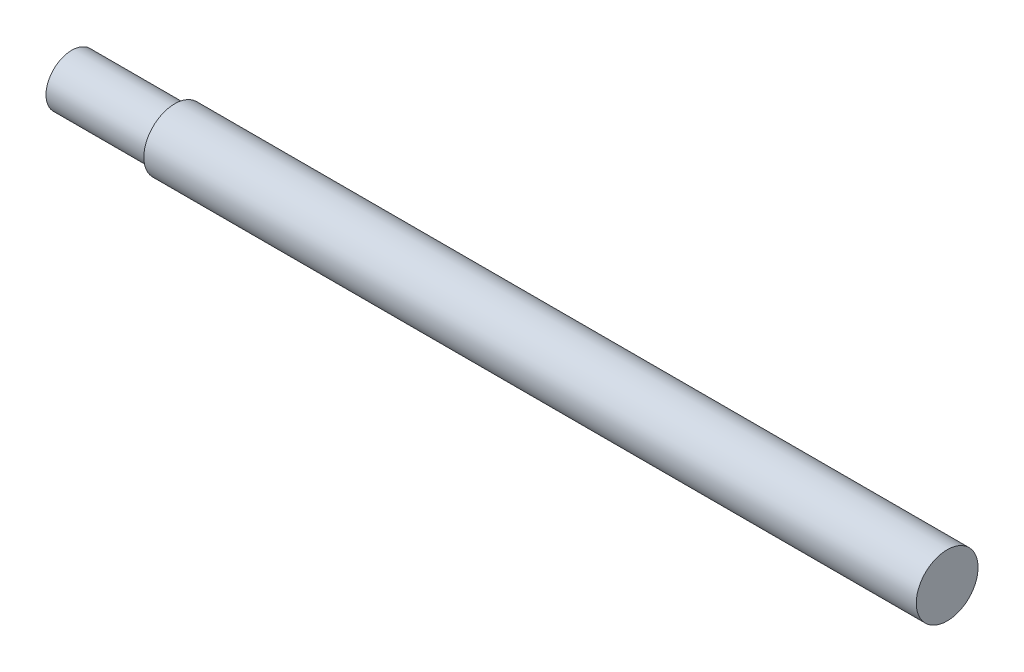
SolidWorks part; units mm, degrees
ref_plane "Face" through (0, 0, 0) normal (0, 0, 1) x (1, 0, 0)
ref_plane "Dessus" through (0, 0, 0) normal (0, 1, 0) x (1, 0, 0)
ref_plane "Droite" through (0, 0, 0) normal (1, 0, 0) x (0, 0, -1)
sketch "Esquisse1" plane through (0, 0, 0) normal (0, 0, 1) x (1, 0, 0)
  line L0 (-81.6069, 0) -> (67.8624, 0) construction
  line L1 (-75.8303, 0) -> (-75.8303, 5)
  line L2 (-75.8303, 5) -> (-55.8303, 5)
  line L3 (-55.8303, 5) -> (-55.8303, 6)
  line L4 (-55.8303, 6) -> (94.1697, 6)
  line L5 (94.1697, 6) -> (94.1697, 0)
  line L6 (-75.8303, 0) -> (94.1697, 0)
  dimension "D1" = 5
  dimension "D2" = 20
  dimension "D3" = 150
  dimension "D4" = 6
revolve "Révolution1" add sketch "Esquisse1" angle 360 about L0
